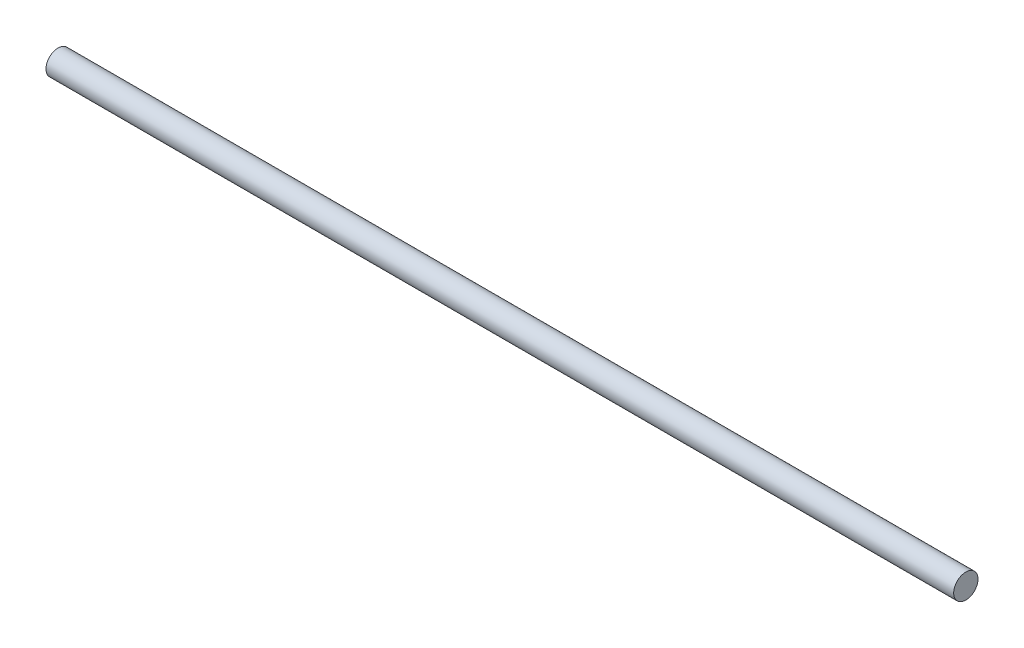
SolidWorks part; units mm, degrees
ref_plane "Front Plane" through (0, 0, 0) normal (0, 0, 1) x (1, 0, 0)
ref_plane "Top Plane" through (0, 0, 0) normal (0, 1, 0) x (1, 0, 0)
ref_plane "Right Plane" through (0, 0, 0) normal (1, 0, 0) x (0, 0, -1)
sketch "Sketch1" plane through (0, 0, 0) normal (1, 0, 0) x (0, 0, -1)
  circle A0 centre (0, 0) radius 2
  dimension "D1" = 4
extrude "Boss-Extrude1" add sketch "Sketch1" along normal blind 149.225
